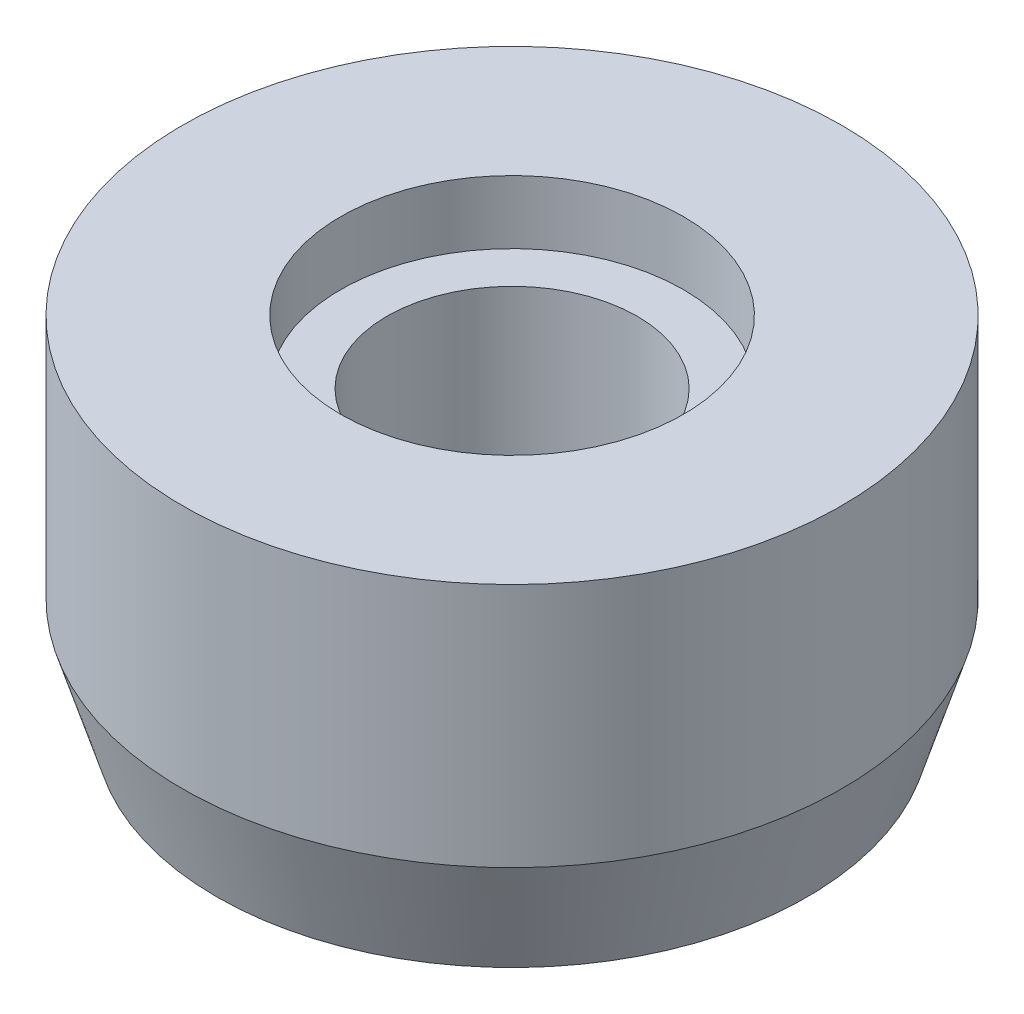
SolidWorks part; units mm, degrees
ref_plane "Front Plane" through (0, 0, 0) normal (0, 0, 1) x (1, 0, 0)
ref_plane "Top Plane" through (0, 0, 0) normal (0, 1, 0) x (1, 0, 0)
ref_plane "Right Plane" through (0, 0, 0) normal (1, 0, 0) x (0, 0, -1)
sketch "Sketch1" plane through (0, 0, 0) normal (0, 0, 1) x (1, 0, 0)
  line L0 (0, -13.5) -> (0, 0) construction
  line L1 (0, 0) -> (12.5, 0) construction
  line L2 (12.5, 0) -> (6.5, 0)
  line L3 (6.5, 0) -> (6.5, -2.4)
  line L4 (6.5, -2.4) -> (4.75, -2.4)
  line L5 (4.75, -2.4) -> (4.75, -13.5)
  line L6 (4.75, -13.5) -> (11.2, -13.5)
  line L7 (11.2, -13.5) -> (12.5, -9.3)
  line L8 (12.5, -9.3) -> (12.5, 0)
  dimension "D1" = 13.5
  dimension "D2" = 12.5
  dimension "D3" = 2.4
  dimension "D4" = 6
  dimension "D5" = 4.2
  dimension "D6" = 1.3
  dimension "D7" = 4.75
revolve "Revolve1" add sketch "Sketch1" angle 360 about L0
